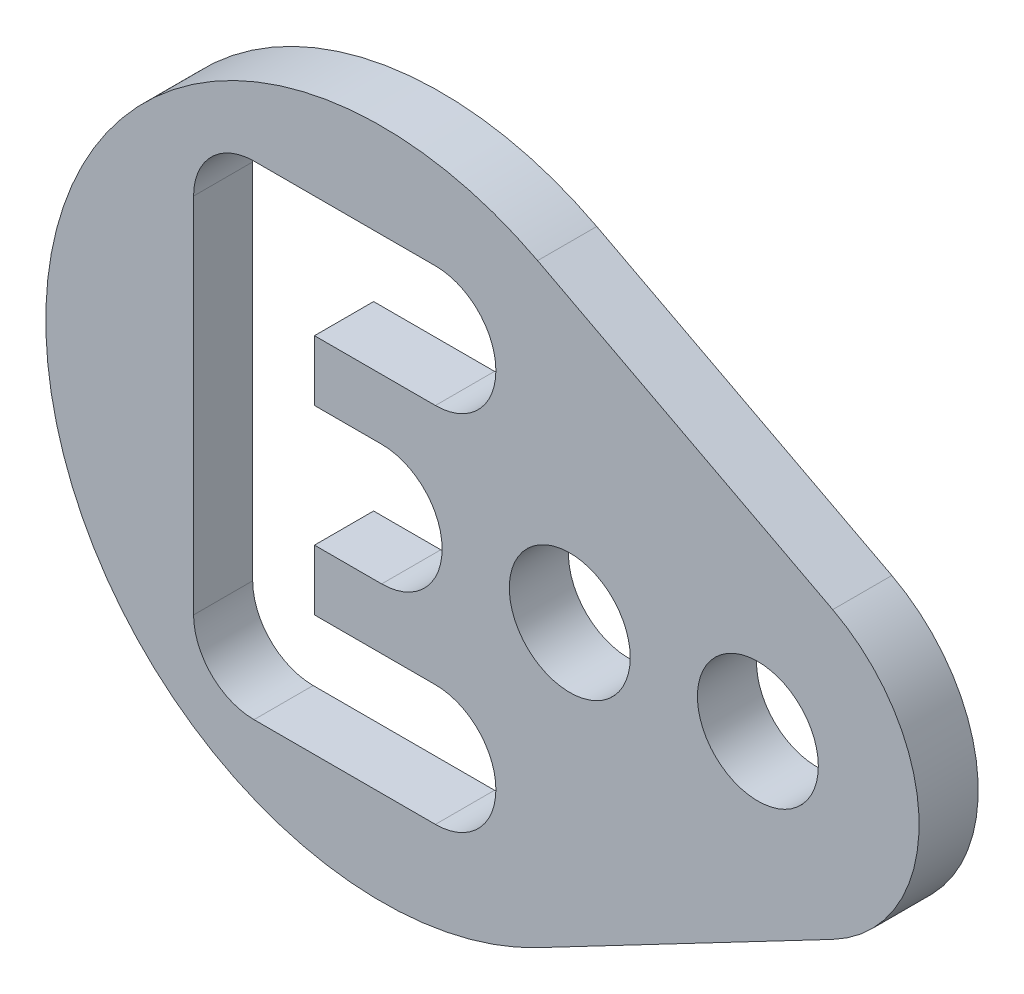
SolidWorks part; units mm, degrees
ref_plane "Alzado" through (0, 0, 0) normal (0, 0, 1) x (1, 0, 0)
ref_plane "Planta" through (0, 0, 0) normal (0, 1, 0) x (1, 0, 0)
ref_plane "Vista lateral" through (0, 0, 0) normal (1, 0, 0) x (0, 0, -1)
sketch "Croquis1" plane through (0, 0, 0) normal (0, 0, 1) x (1, 0, 0)
  line L0 (-1.4287, -7.5239) -> (11.9109, -7.5239) construction
  line L1 (9, 13.5) -> (4.5, 13.5)
  line L2 (2.25, 0) -> (9, 0)
  line L3 (0, 2.25) -> (0, 15.75)
  line L4 (2.25, 18) -> (9, 18)
  line L6 (4.5, 13.5) -> (4.5, 11.25)
  line L7 (4.5, 11.25) -> (7, 11.25)
  line L9 (7, 6.75) -> (4.5, 6.75)
  line L10 (4.5, 6.75) -> (4.5, 4.5)
  line L11 (4.5, 4.5) -> (9, 4.5)
  line L14 (7, 9) -> (14, 9) construction
  line L15 (14, 9) -> (21, 9) construction
  line L19 (12.8036, -2.0711) -> (23.7857, 3.6859)
  line L20 (23.7857, 14.3141) -> (12.8036, 20.0711)
  arc A0 (9, 18) -> (9, 13.5) centre (9, 15.75) cw
  arc A1 (9, 0) -> (9, 4.5) centre (9, 2.25) ccw
  arc A2 (7, 11.25) -> (7, 6.75) centre (7, 9) cw
  arc A3 (2.25, 0) -> (0, 2.25) centre (2.25, 2.25) cw
  arc A4 (0, 15.75) -> (2.25, 18) centre (2.25, 15.75) cw
  circle A5 centre (14, 9) radius 2.25
  circle A6 centre (21, 9) radius 2.25
  arc A8 (12.8036, 20.0711) -> (12.8036, -2.0711) centre (7, 9) ccw
  arc A9 (23.7857, 3.6859) -> (23.7857, 14.3141) centre (21, 9) ccw
  point P22 (0, 0)
  dimension "D4" = 9
  dimension "D6" = 2.25
  dimension "D7" = 4.5
  dimension "D8" = 7
  dimension "D9" = 12.5
  dimension "D10" = 6
  dimension "D1" = 18
  dimension "D2" = 4.5
  dimension "D3" = 4.5
  dimension "D5" = 7
extrude "Saliente-Extruir1" add sketch "Croquis1" along normal blind 2.2
